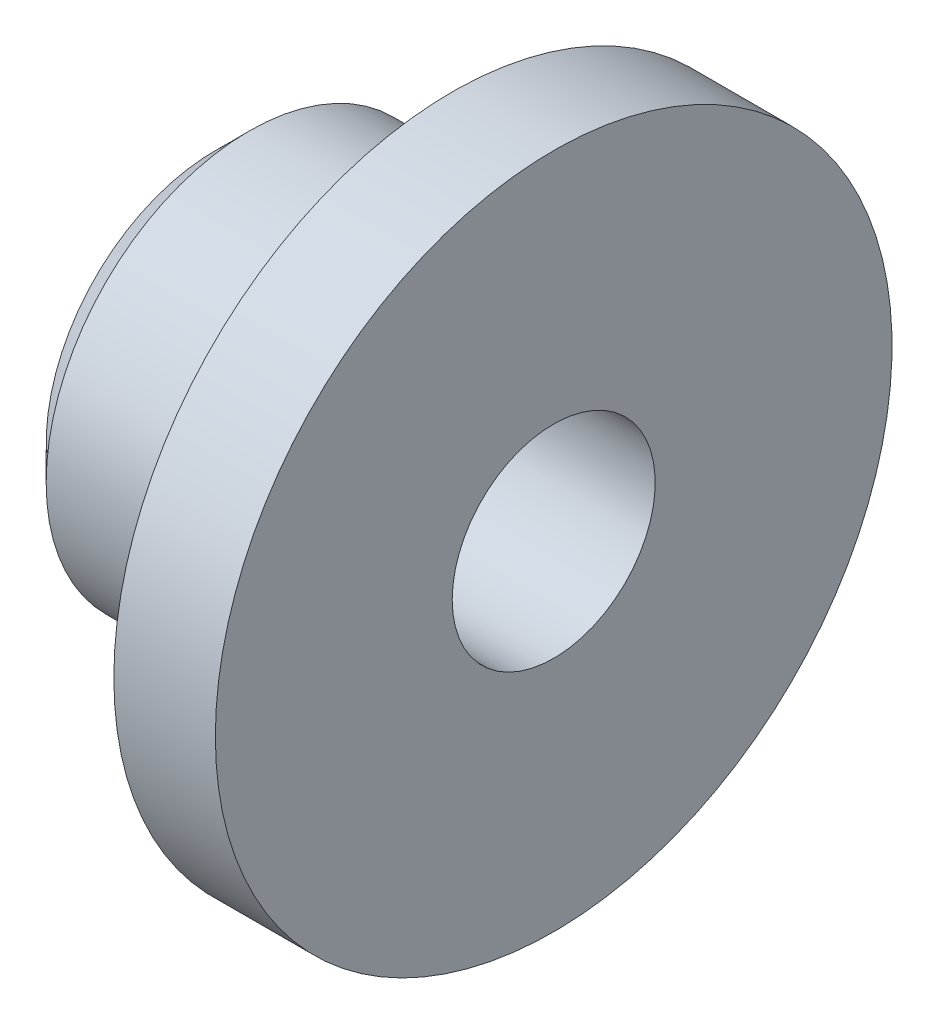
SolidWorks part; units mm, degrees
ref_plane "Plan de face" through (0, 0, 0) normal (0, 0, 1) x (1, 0, 0)
ref_plane "Plan de dessus" through (0, 0, 0) normal (0, 1, 0) x (1, 0, 0)
ref_plane "Plan de droite" through (0, 0, 0) normal (1, 0, 0) x (0, 0, -1)
ref_plane "Plan1" through (0, 0, -20.981) normal (0, 0, -1) x (-1, 0, 0)
sketch "Esquisse1" plane through (0, 0, -20.981) normal (0, 0, -1) x (-1, 0, 0)
  line L0 (176.5919, 39.8256) -> (176.5919, -8.6744) construction
  line L1 (176.5919, 38.3256) -> (176.5919, 34.8256)
  line L2 (152.0919, 38.3256) -> (181.0919, 38.3256) construction
  line L3 (176.5919, 38.3256) -> (181.5919, 38.3256)
  line L4 (181.5919, 38.8256) -> (181.5919, 40.8256) construction
  line L5 (181.5919, 36.8256) -> (181.5919, 38.3256)
  line L6 (181.5919, 36.8256) -> (178.0919, 36.8256)
  line L7 (178.0919, 36.8256) -> (178.0919, 34.8256)
  line L8 (178.0919, 34.8256) -> (176.5919, 34.8256)
  line L10 (182.4725, 39.8256) -> (174.7904, 39.8256) construction
  line L11 (175.5919, 39.8256) -> (157.5919, 39.8256) construction
  dimension "D1" = 6
  dimension "D2" = 10
  dimension "D3" = 1.5
revolve "Révolution1" add sketch "Esquisse1" angle 360 about L10
chamfer "Chanfrein1" distance 0.5 angle 45 1 edges at (-181.5919, 39.8256, -17.981)
